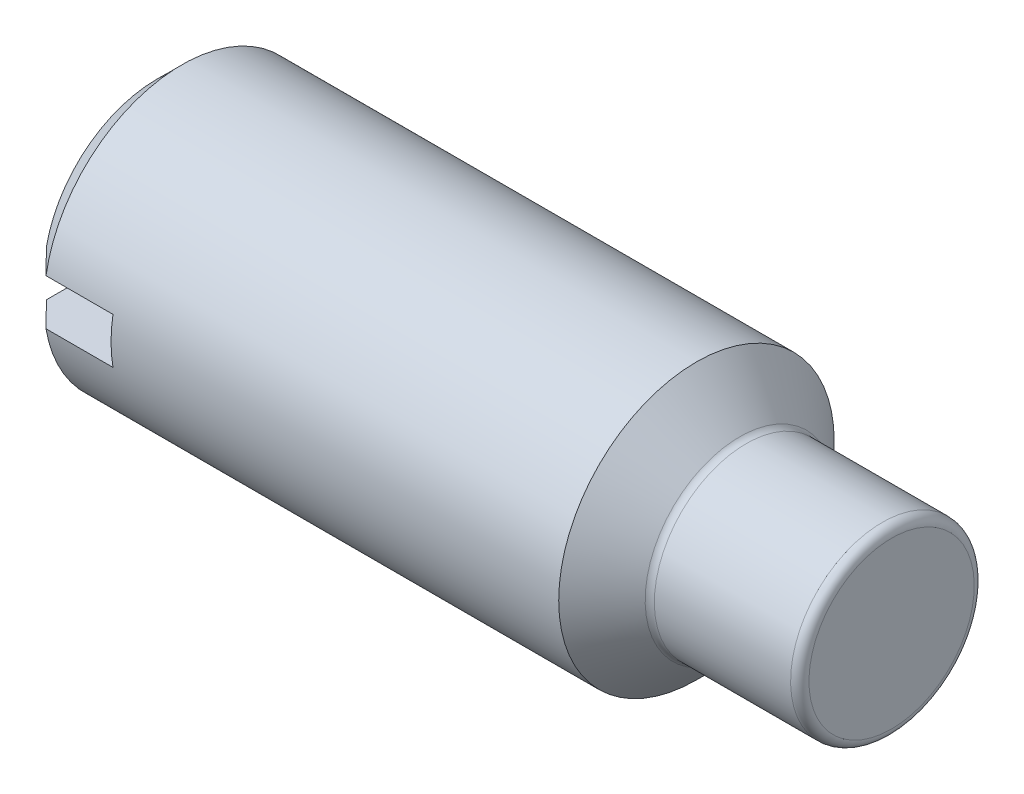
SolidWorks part; units mm, degrees
ref_plane "Front" through (0, 0, 0) normal (0, 0, 1) x (1, 0, 0)
ref_plane "Top" through (0, 0, 0) normal (0, 1, 0) x (1, 0, 0)
ref_plane "Right" through (0, 0, 0) normal (1, 0, 0) x (0, 0, -1)
sketch "Sketch1" plane through (0, 0, 0) normal (0, 0, 1) x (1, 0, 0)
  line L0 (16, 0) -> (0, 0)
  line L1 (16, 0) -> (16, 2)
  line L2 (16, 2) -> (12.75, 2)
  line L3 (12.75, 2) -> (11.75, 3)
  line L4 (11.75, 3) -> (0, 3)
  line L5 (-8.5703, 0) -> (3.0325, 0) construction
  line L7 (0, 3) -> (0, 0)
  dimension "D1" = 45
  dimension "l" = 16
  dimension "d" = 6
  dimension "z" = 3.25
  dimension "dp" = 4
revolve "Base" add sketch "Sketch1" angle 360 about L5
sketch "Sketch2" plane through (0, 0, 0) normal (0, 0, 1) x (1, 0, 0)
  line L0 (0, 3) -> (0, -3) construction
  line L1 (0, 0.5) -> (2, 0.5)
  line L2 (0, 0.5) -> (0, -0.5)
  line L3 (0, -0.5) -> (2, -0.5)
  line L4 (2, 0.5) -> (2, -0.5)
  dimension "m" = 0.5
  dimension "n" = 1
  dimension "t" = 2
extrude "Notch" cut sketch "Sketch2" against normal through all and the other way through all
fillet "Fillet1" radius 0.2 2 edges at (16, -2, 0) (12.75, -2, 0)
chamfer "Chamfer1" distance 0.5415 angle 45 2 edges at (0, 3, 0) (0, -3, 0)
sketch "Sketch3" plane through (0, 0, 0) normal (0, 0, 1) x (1, 0, 0)
  line L0 (0.5415, 2.531) -> (0.8122, 3)
  line L1 (0.8122, 3) -> (0.8123, 3.5415)
  line L2 (0.8123, 3.5415) -> (0.2707, 3.5415)
  line L3 (0.2707, 3.5415) -> (0.2707, 3)
  line L4 (0.2707, 3) -> (0.5415, 2.531)
  line L5 (0, 0) -> (1.285, 0) construction
  line L7 (0, 2.4585) -> (0, 0.5) construction
  dimension "D1" = 6
  dimension "D2" = 0.5415
  dimension "D3" = 0.5415
revolve "Cut-Revolve10" [suppressed] cut sketch "Sketch3" angle 360 about L5
pattern_linear "LPattern10" [suppressed] count 19 spacing 0.6498 along (1, 0, 0)
equation "\"D1@Chamfer1\" = (  \"d@Sketch1\" - \"D1@ThreadCosmetic1\" )  / 2"
equation "\"m@Sketch2\" = \"n@Sketch2\" / 2"
equation "\"D3@Sketch3\" = \"D1@Chamfer1\""
equation "\"D1@Sketch3\" = \"d@Sketch1\""
equation "\"D2@Sketch3\" =  ( \"d@Sketch1\" - \"D1@ThreadCosmetic1\" )  / 2"
equation "\"D3@LPattern10\" = \"D2@Sketch3\" * 1.2"
equation "\"D1@LPattern10\" =  ( \"l@Sketch1\" - \"z@Sketch1\" - \"D1@Chamfer1\" )  / \"D3@LPattern10\""
